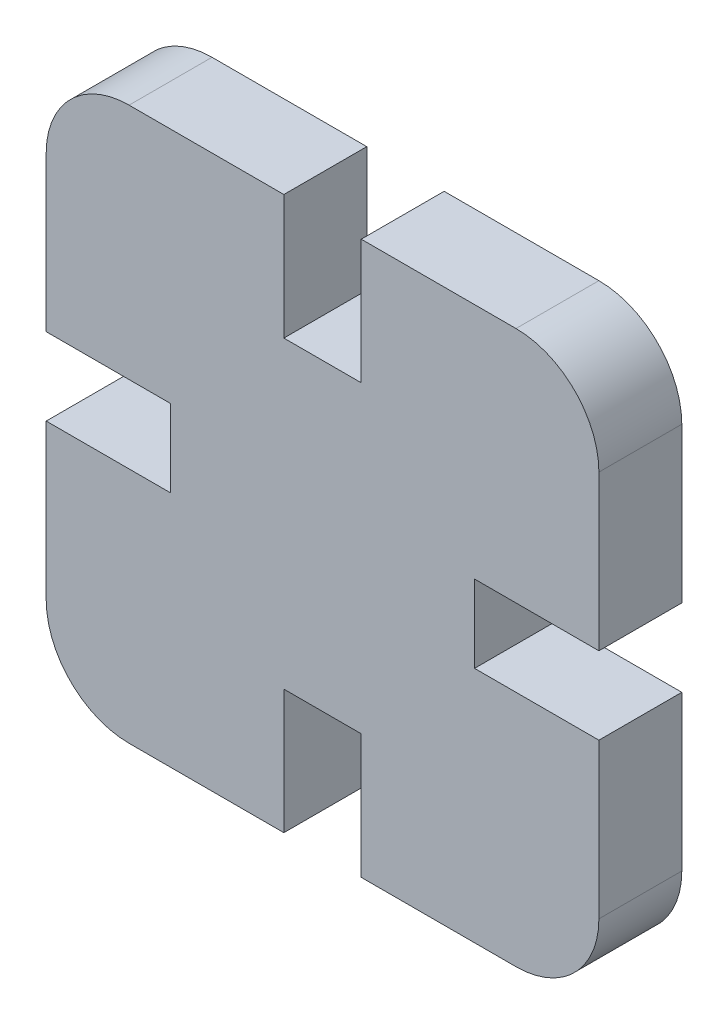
SolidWorks part; units mm, degrees
ref_plane "Plan de face" through (0, 0, 0) normal (0, 0, 1) x (1, 0, 0)
ref_plane "Plan de dessus" through (0, 0, 0) normal (0, 1, 0) x (1, 0, 0)
ref_plane "Plan de droite" through (0, 0, 0) normal (1, 0, 0) x (0, 0, -1)
sketch "Esquisse1" plane through (0, 0, 0) normal (0, 0, 1) x (1, 0, 0)
  line L1 (-7, -10) -> (-1.4, -10)
  line L2 (-10, -7) -> (-10, -1.4)
  line L3 (-7, 10) -> (-1.4, 10)
  line L4 (10, -7) -> (10, -1.4)
  line L5 (-10, -10) -> (10, 10) construction
  line L6 (-10, 10) -> (10, -10) construction
  line L9 (-10, 1.4) -> (-5.5, 1.4)
  line L10 (-5.5, 1.4) -> (-5.5, -1.4)
  line L11 (-5.5, -1.4) -> (-10, -1.4)
  line L12 (-1.4, 5.5) -> (-1.4, 10)
  line L14 (1.4, 10) -> (1.4, 5.5)
  line L15 (1.4, 5.5) -> (-1.4, 5.5)
  line L16 (5.5, 1.4) -> (10, 1.4)
  line L18 (10, -1.4) -> (5.5, -1.4)
  line L19 (5.5, -1.4) -> (5.5, 1.4)
  line L20 (1.4, -5.5) -> (1.4, -10)
  line L22 (-1.4, -10) -> (-1.4, -5.5)
  line L23 (-1.4, -5.5) -> (1.4, -5.5)
  line L24 (-10, 1.4) -> (-10, 7)
  line L25 (1.4, 10) -> (7, 10)
  line L26 (1.4, -10) -> (7, -10)
  line L27 (10, 1.4) -> (10, 7)
  arc A0 (-10, -7) -> (-7, -10) centre (-7, -7) ccw
  arc A1 (7, -10) -> (10, -7) centre (7, -7) ccw
  arc A2 (10, 7) -> (7, 10) centre (7, 7) ccw
  arc A3 (-7, 10) -> (-10, 7) centre (-7, 7) ccw
  point P0 (0, 0)
  point P13 (0, 0)
  point P30 (0, 0)
  point P40 (0, 0)
  point P41 (-5.5, 0)
extrude "Boss.-Extru.1" add sketch "Esquisse1" along normal blind 3
equation "\"thickness\"= 3"
equation "\"adjustement\"= 0.2"
equation "\"depth\" = \"thickness\" * 1.5"
equation "\"widht\"= \"thickness\" - \"adjustement\""
equation "\"gap\"= \"depth\" * 2"
equation "\"D5@Esquisse1\"=\"widht\""
equation "\"D6@Esquisse1\"=\"depth\""
equation "\"D1@Boss.-Extru.1\"=\"thickness\""
